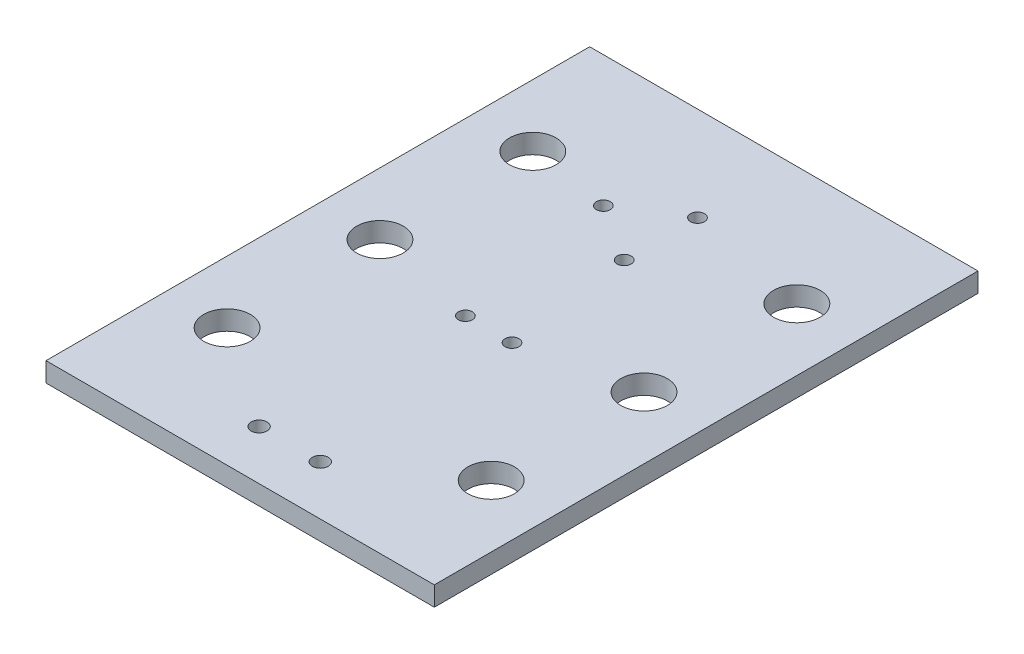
SolidWorks part; units mm, degrees
ref_plane "Front Plane" through (0, 0, 0) normal (0, 0, 1) x (1, 0, 0)
ref_plane "Top Plane" through (0, 0, 0) normal (0, 1, 0) x (1, 0, 0)
ref_plane "Right Plane" through (0, 0, 0) normal (1, 0, 0) x (0, 0, -1)
sketch "Sketch1" plane through (0, 0, 0) normal (0, 1, 0) x (1, 0, 0)
  line L0 (0, 0) -> (0, 44.45) construction
  line L1 (-15.875, 44.45) -> (15.875, 44.45)
  line L2 (-15.875, 44.45) -> (-15.875, 0)
  line L3 (-15.875, 0) -> (15.875, 0)
  line L4 (15.875, 44.45) -> (15.875, 0)
  circle A0 centre (-10.795, 9.7257) radius 1.905
  circle A1 centre (-10.795, 22.225) radius 1.905
  circle A2 centre (-10.795, 34.7218) radius 1.905
  circle A3 centre (-2.4994, 4.0488) radius 0.6477
  circle A4 centre (-1.905, 20.32) radius 0.5715
  circle A5 centre (0.635, 30.7594) radius 0.5715
  circle A6 centre (-4.064, 33.7566) radius 0.5715
  circle A7 centre (0.635, 36.7538) radius 0.5715
  circle A8 centre (10.795, 34.7218) radius 1.905
  circle A9 centre (1.905, 20.32) radius 0.5715
  circle A10 centre (10.795, 22.225) radius 1.905
  circle A11 centre (10.795, 9.7257) radius 1.905
  circle A12 centre (2.4994, 4.0488) radius 0.6477
  point P4 (0, 0)
other "AlignGroup1" parameters "D3"=4.014, "D4"=2.0442, "D5"=2.0887, "D16"=1.143, "D19"=1.2954, "D1"=78.0609, "D2"=57.5262, "D6"=0, "D7"=4.0488, "D8"=9.7257, "D9"=20.32, "D10"=22.225, "D11"=30.7594, "D12"=33.7566, "D13"=34.7218, "D14"=36.7538, "D15"=44.45, "D17"=44.45, "D18"=44.45
extrude "Boss-Extrude1" add sketch "Sketch1" along normal blind 1.5875
